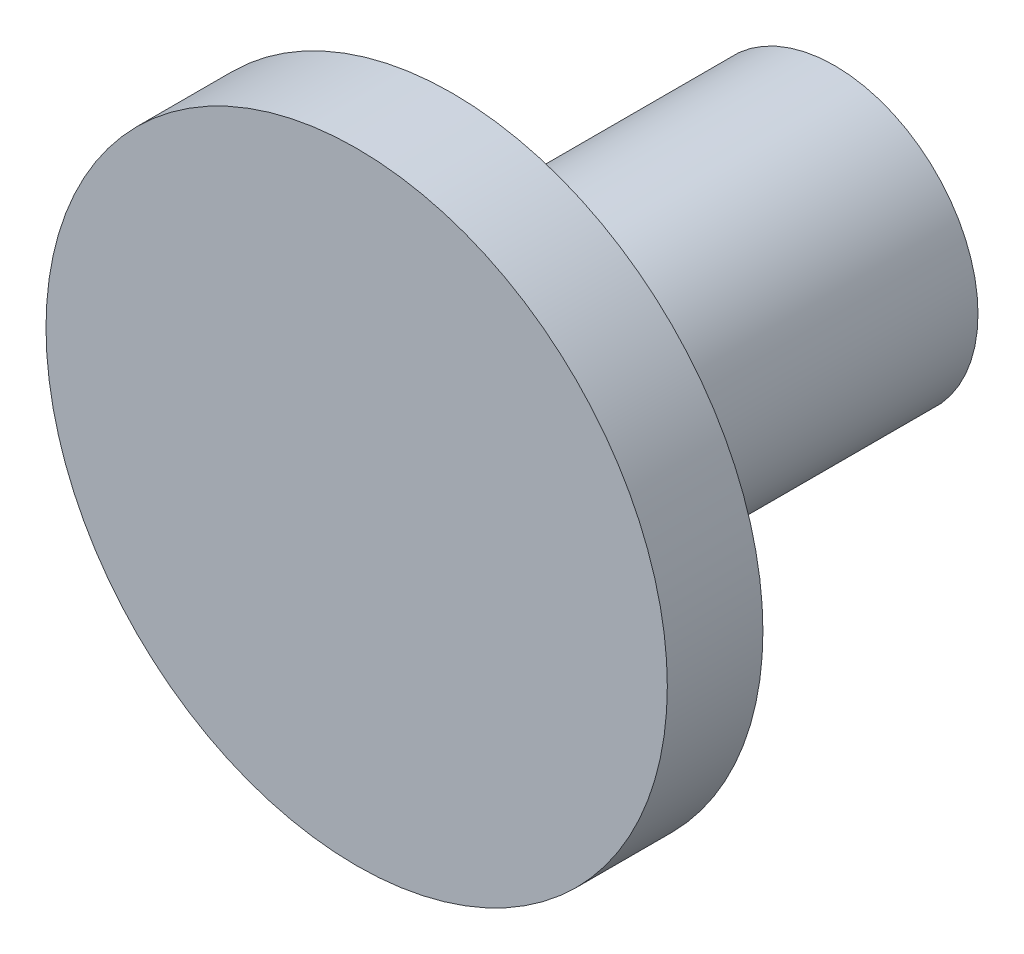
SolidWorks part; units mm, degrees
ref_plane "Plan de face" through (0, 0, 0) normal (0, 0, 1) x (1, 0, 0)
ref_plane "Plan de dessus" through (0, 0, 0) normal (0, 1, 0) x (1, 0, 0)
ref_plane "Plan de droite" through (0, 0, 0) normal (1, 0, 0) x (0, 0, -1)
sketch "Esquisse2" plane through (0, 0, 0) normal (0, 0, 1) x (1, 0, 0)
  circle A0 centre (19, 0) radius 1.5 construction
  circle A1 centre (19, 0) radius 1.5
extrude "Extrusion1" add sketch "Esquisse2" against normal blind 4
sketch "Esquisse3" plane through (0, 0, 0) normal (0, 0, 1) x (1, 0, 0)
  circle A0 centre (19, 0) radius 3.25 construction
  circle A1 centre (19, 0) radius 3.25
extrude "Extrusion2" add sketch "Esquisse3" along normal blind 1
